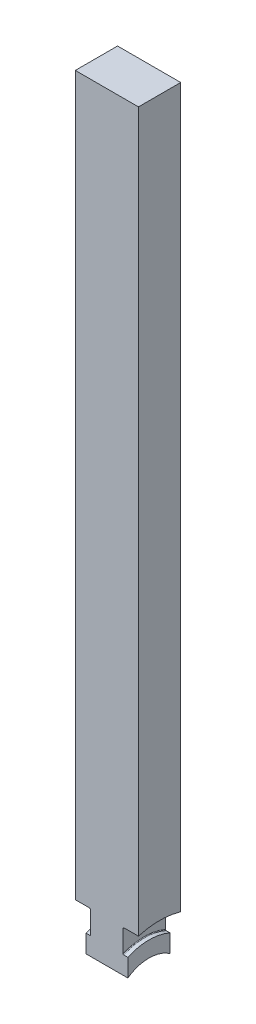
SolidWorks part; units mm, degrees
ref_plane "Front Plane" through (0, 0, 0) normal (0, 0, 1) x (1, 0, 0)
ref_plane "Top Plane" through (0, 0, 0) normal (0, 1, 0) x (1, 0, 0)
ref_plane "Right Plane" through (0, 0, 0) normal (1, 0, 0) x (0, 0, -1)
sketch "Sketch1" plane through (0, 0, 0) normal (1, 0, 0) x (0, 0, -1)
  line L0 (-12.827, 479.425) -> (-12.827, 0)
  line L1 (0, 249.2329) -> (0, 0) construction
  line L2 (12.827, 479.425) -> (12.827, 0)
  line L3 (-12.827, 479.425) -> (12.827, 479.425)
  line L6 (-12.827, 0) -> (12.827, 0)
  arc A0 (-22.225, 0) -> (22.225, 0) centre (0, 0) cw construction
  dimension "R" = 22.225
  dimension "L" = 457.2
  dimension "T" = 25.654
extrude "Boss-Extrude1" add sketch "Sketch1" along normal mid plane 38.354
sketch "Sketch8" plane through (0, 0, 0) normal (1, 0, 0) x (0, 0, -1)
  circle A0 centre (0, 0) radius 22.225
  arc A1 (22.225, 0) -> (-22.225, 0) centre (0, 0) ccw construction
extrude "Cut-Extrude4" cut sketch "Sketch8" against normal through all both and the other way through all
sketch "Sketch2" plane through (0, 0, 0) normal (0, 0, 1) x (1, 0, 0)
  line L0 (19.177, 31.75) -> (9.8552, 31.75)
  line L1 (19.177, 479.425) -> (19.177, 18.1499) construction
  line L2 (9.8552, 31.75) -> (9.8552, 45.2374)
  line L3 (9.8552, 45.2374) -> (19.177, 45.2374)
  line L4 (19.177, 45.2374) -> (19.177, 31.75)
  line L5 (0, 29.9173) -> (0, 0) construction
  line L6 (-19.177, 45.2374) -> (-19.177, 31.75)
  line L7 (-9.8552, 45.2374) -> (-19.177, 45.2374)
  line L8 (-9.8552, 31.75) -> (-9.8552, 45.2374)
  line L9 (-19.177, 31.75) -> (-9.8552, 31.75)
  line L10 (-8.8482, 0) -> (24.5305, 0) construction
  dimension "D1" = 19.7104
  dimension "D2" = 45.2374
  dimension "D3" = 31.75
revolve "Cut-Revolve1" cut sketch "Sketch2" angle 360 about L10
sketch "Sketch7" plane through (0, 0, 0) normal (0, 0, 1) x (1, 0, 0)
  line L6 (-19.177, 31.75) -> (-12.7, 31.75)
  line L8 (-19.177, 31.75) -> (-19.177, 0)
  line L9 (-19.177, 0) -> (-12.7, 0)
  line L10 (-12.7, 31.75) -> (-12.7, 0)
  line L11 (0, 16.5651) -> (0, 5.9342) construction
  line L12 (12.7, 31.75) -> (12.7, 0)
  line L13 (19.177, 0) -> (12.7, 0)
  line L14 (19.177, 31.75) -> (19.177, 0)
  line L15 (19.177, 31.75) -> (12.7, 31.75)
  dimension "MW" = 25.4
extrude "Cut-Extrude3" cut sketch "Sketch7" against normal through all both and the other way through all
fillet "Fillet1" radius 0.762 2 edges at (-9.8552, 45.2374, 0) (9.8552, 45.2374, 0)
fillet "Fillet2" radius 0.381 2 edges at (-9.8552, 31.75, 0) (9.8552, 31.75, 0)
